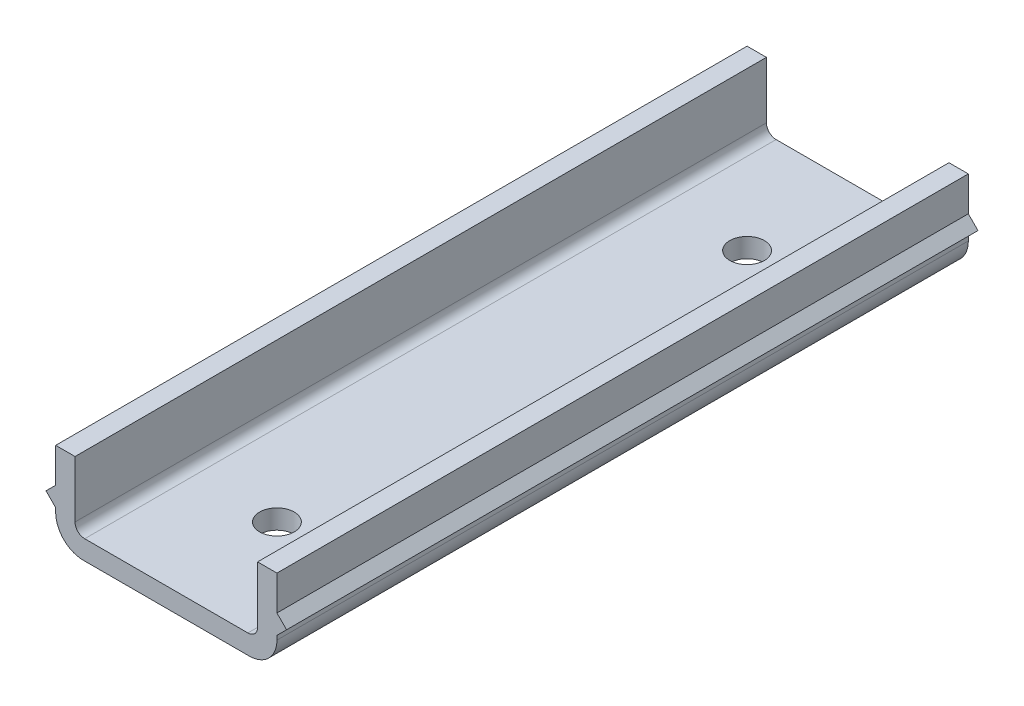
SolidWorks part; units mm, degrees
ref_plane "Front" through (0, 0, 0) normal (0, 0, 1) x (1, 0, 0)
ref_plane "bottom" through (0, 0, 0) normal (0, 1, 0) x (1, 0, 0)
ref_plane "center" through (0, 0, 0) normal (1, 0, 0) x (0, 0, -1)
sketch "Sketch2" plane through (0, 0, 0) normal (0, 0, 1) x (1, 0, 0)
  line L0 (6.6, 6.2) -> (8, 6.2)
  line L1 (8.7, 3) -> (8, 2.3)
  line L2 (0, 1.4) -> (0, 0)
  line L3 (0, 0) -> (8, 0)
  line L4 (8, 2.3) -> (8, 0)
  line L5 (8, 6.2) -> (8, 3.7)
  line L6 (8, 3.7) -> (8.7, 3)
  line L7 (6.6, 6.2) -> (6.6, 1.4)
  line L8 (6.6, 1.4) -> (0, 1.4)
  dimension "D1" = 8
  dimension "D2" = 0.7
  dimension "D3" = 135
  dimension "D4" = 2.5
  dimension "D5" = 6.2
  dimension "D6" = 1.4
  dimension "D7" = 1.4
extrude "Extrude3" add sketch "Sketch2" along normal blind 50
fillet "Fillet1" radius 2 1 edges at (8, 0, 25)
fillet "Fillet2" radius 0.7 1 edges at (6.6, 1.4, 25)
mirror "Mirror1" about plane through (0, 0, 0) normal (1, 0, 0) of "Fillet2", "Fillet1", "Extrude3"
hole_wizard "M3x0.5 Tapped Hole1" positions "Sketch4" profile "Sketch3" tap size "M3x0.5" standard "Ansi Metric"
sketch "Sketch4" plane through (0, 6.2, 0) normal (0, 1, 0) x (-1, 0, 0)
  line L0 (-8, 0) -> (-6.6, 0) construction
  point P0 (0, 8)
  dimension "D1" = 8
sketch "Sketch3" plane through (0, 6.2, 8) normal (1, 0, 0) x (0, 0, 1)
  line L0 (0, 0) -> (0, 6.2)
  line L1 (0, 6.2) -> (1.25, 6.2)
  line L2 (1.25, 6.2) -> (1.25, 0)
  line L5 (1.25, 0) -> (0, 0)
  line L11 (0, -6.35) -> (0, 107.95) construction
  dimension "Thru Tap Drill Dia." = 2.5
  dimension "Thru Tap Drill Depth" = 6.2
pattern_linear "LPattern1" count 2 spacing 34 along (0, 0, 1) of "M3x0.5 Tapped Hole1"
